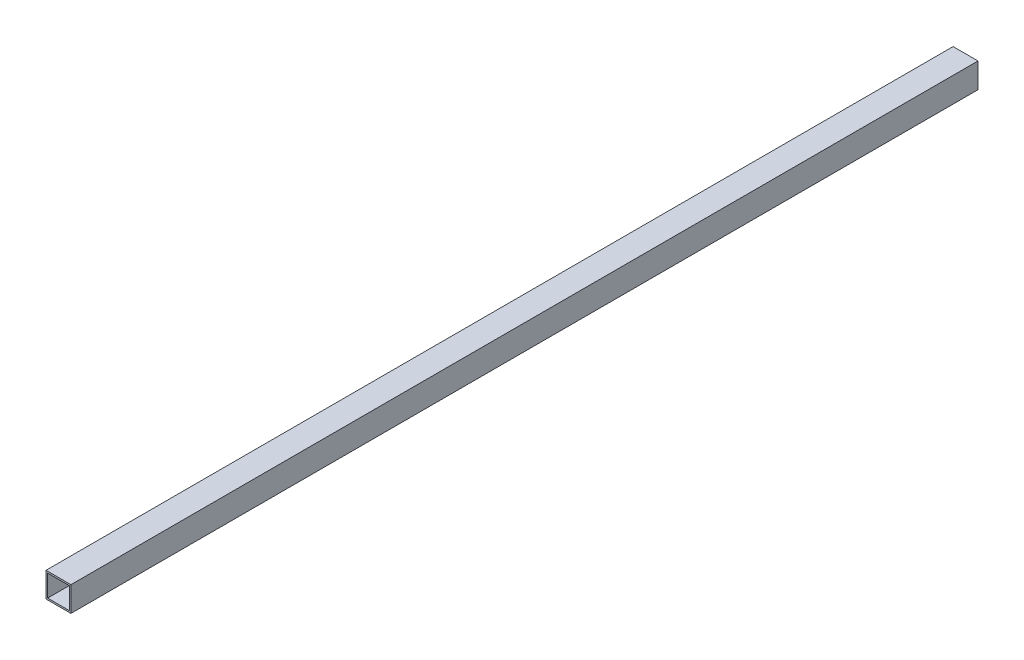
SolidWorks part; units mm, degrees
ref_plane "Plan de face" through (0, 0, 0) normal (0, 0, 1) x (1, 0, 0)
ref_plane "Plan de dessus" through (0, 0, 0) normal (0, 1, 0) x (1, 0, 0)
ref_plane "Plan de droite" through (0, 0, 0) normal (1, 0, 0) x (0, 0, -1)
sketch "Esquisse1" plane through (0, 0, 0) normal (0, 0, 1) x (1, 0, 0)
  line L0 (-32.7851, 0) -> (47.4143, 0) construction
  line L1 (-15, 15) -> (15, 15)
  line L2 (-15, 15) -> (-15, -15)
  line L3 (-15, -15) -> (15, -15)
  line L4 (15, 15) -> (15, -15)
  line L5 (0, 21.8132) -> (0, -24.1643) construction
  dimension "D1" = 30
  dimension "D2" = 30
extrude "Extru.-Mince1" add sketch "Esquisse1" along normal blind 1092 thin
